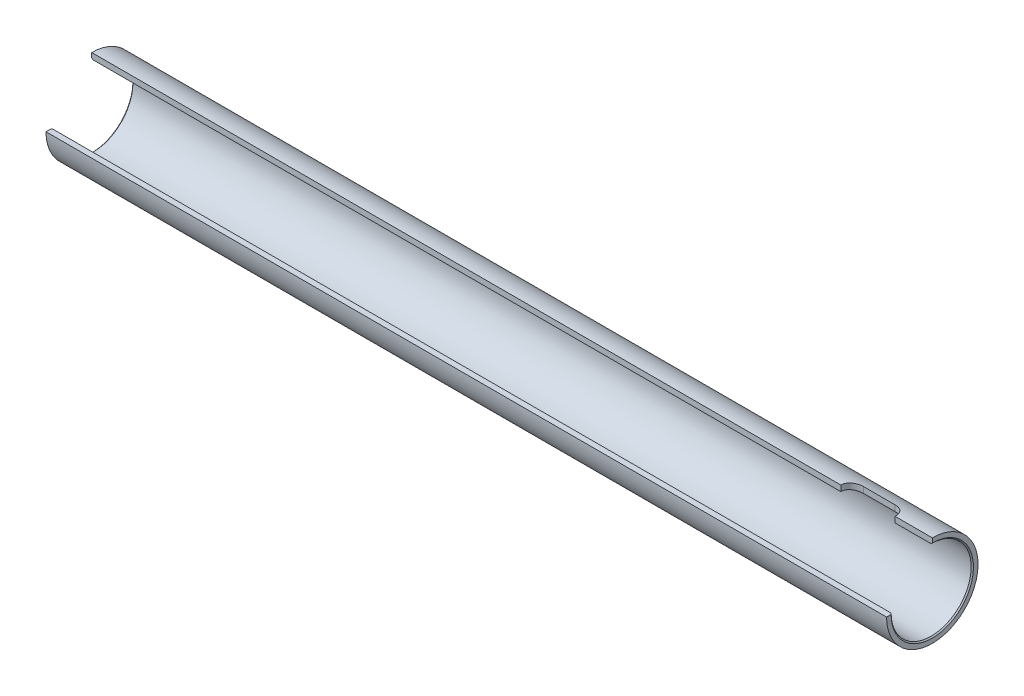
SolidWorks part; units mm, degrees
ref_plane "Face" through (0, 0, 0) normal (0, 0, 1) x (1, 0, 0)
ref_plane "Dessus" through (0, 0, 0) normal (0, 1, 0) x (1, 0, 0)
ref_plane "Droite" through (0, 0, 0) normal (1, 0, 0) x (0, 0, -1)
sketch "Esquisse1" plane through (0, 0, 0) normal (1, 0, 0) x (0, 0, -1)
  circle A0 centre (0, 0) radius 8
  circle A1 centre (0, 0) radius 7
  dimension "D1" = 16
  dimension "D2" = 14
extrude "Base-Extrusion" add sketch "Esquisse1" against normal blind 147
sketch "Esquisse2" plane through (0, 0, 0) normal (0, 1, 0) x (1, 0, 0)
  line L0 (7.1913, 0) -> (-40.4846, 0) construction
  line L1 (-147, 0) -> (0, 0) construction
  line L2 (-14, 2) -> (-8.5, 2)
  line L3 (-14, -2) -> (-8.5, -2)
  arc A0 (-14, 2) -> (-14, -2) centre (-14, 0) ccw
  arc A1 (-8.5, -2) -> (-8.5, 2) centre (-8.5, 0) ccw
  dimension "D2" = 9.5
  dimension "D3" = 8.5
  dimension "D1" = 4
extrude "Enlèv. mat.-Extru.1" cut sketch "Esquisse2" along normal up to surface (7.746 mm away)
chamfer "Chanfrein1" distance 0.2 angle 45 2 edges at (-147, 0, -7) (0, 0, -7)
sketch "Esquisse3" plane through (0, 0, 0) normal (1, 0, 0) x (0, 0, -1)
  line L0 (0, 0) -> (0, 8)
  line L1 (0, 0) -> (-8, 0)
  circle A0 centre (0, 0) radius 8 construction
  arc A1 (0, 8) -> (-8, 0) centre (0, 0) ccw
extrude "COUPE" cut sketch "Esquisse3" against normal up to next
